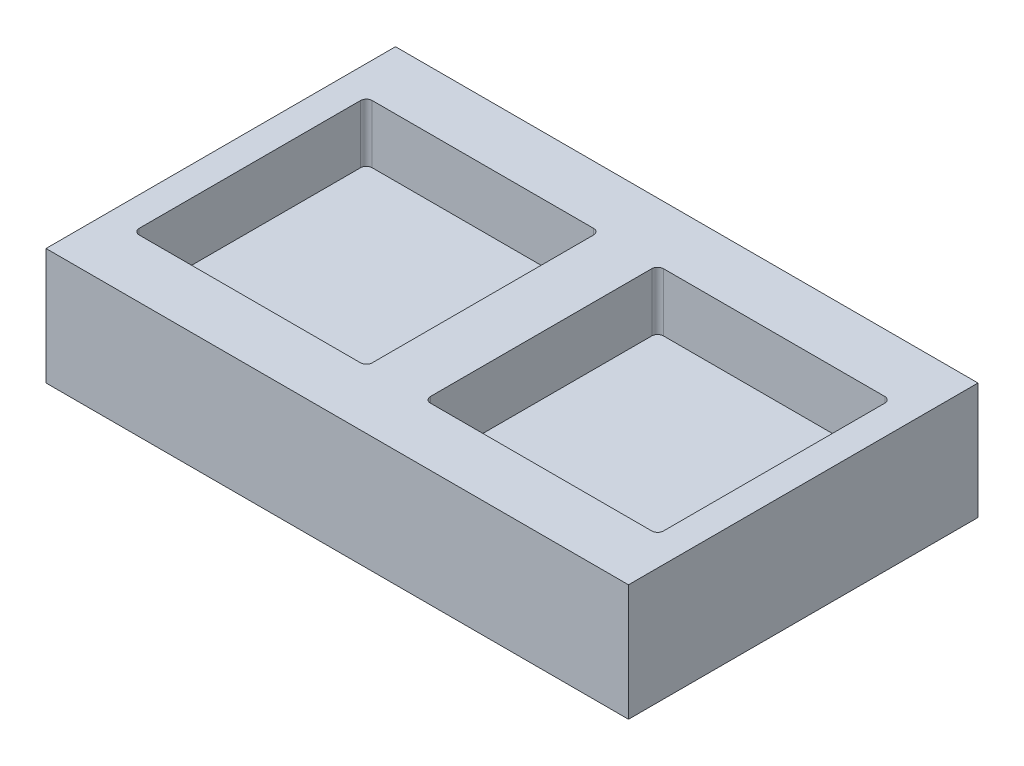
SolidWorks part; units mm, degrees
ref_plane "Front Plane" through (0, 0, 0) normal (0, 0, 1) x (1, 0, 0)
ref_plane "Top Plane" through (0, 0, 0) normal (0, 1, 0) x (1, 0, 0)
ref_plane "Right Plane" through (0, 0, 0) normal (1, 0, 0) x (0, 0, -1)
sketch "Sketch1" plane through (0, 0, 0) normal (0, 1, 0) x (1, 0, 0)
  line L0 (-63.5, -38.1) -> (63.5, 38.1) construction
  line L1 (-63.5, 38.1) -> (63.5, 38.1)
  line L2 (-63.5, 38.1) -> (-63.5, -38.1)
  line L3 (-63.5, -38.1) -> (63.5, -38.1)
  line L4 (63.5, 38.1) -> (63.5, -38.1)
  dimension "D1" = 127
  dimension "D2" = 76.2
extrude "Extrude1" add sketch "Sketch1" along normal blind 25.4
sketch "Sketch2" plane through (0, 25.4, 0) normal (0, 1, 0) x (-1, 0, 0)
  line L0 (-57.15, -25.4) -> (-57.15, 25.4)
  line L1 (-57.15, 25.4) -> (-6.35, 25.4)
  line L2 (-6.35, 25.4) -> (-6.35, -25.4)
  line L3 (63.5, -38.1) -> (63.5, 38.1) construction
  line L4 (-63.5, 38.1) -> (-63.5, -38.1) construction
  line L5 (6.35, 25.4) -> (57.15, 25.4)
  line L6 (57.15, 25.4) -> (57.15, -25.4)
  line L7 (57.15, -25.4) -> (6.35, -25.4)
  line L8 (6.35, -25.4) -> (6.35, 25.4)
  line L9 (-63.5, -38.1) -> (63.5, -38.1) construction
  line L11 (-6.35, -25.4) -> (-57.15, -25.4)
  dimension "D1" = 50.8
  dimension "D2" = 50.8
  dimension "D3" = 6.35
  dimension "D4" = 6.35
  dimension "D5" = 12.7
extrude "Cut-Extrude1" cut sketch "Sketch2" against normal blind 12.7
fillet "Fillet1" radius 1.27 8 edges at (6.35, 19.05, -25.4) (57.15, 19.05, -25.4) (57.15, 19.05, 25.4) (6.35, 19.05, 25.4) (-57.15, 19.05, -25.4) (-6.35, 19.05, -25.4) (-6.35, 19.05, 25.4) (-57.15, 19.05, 25.4)
